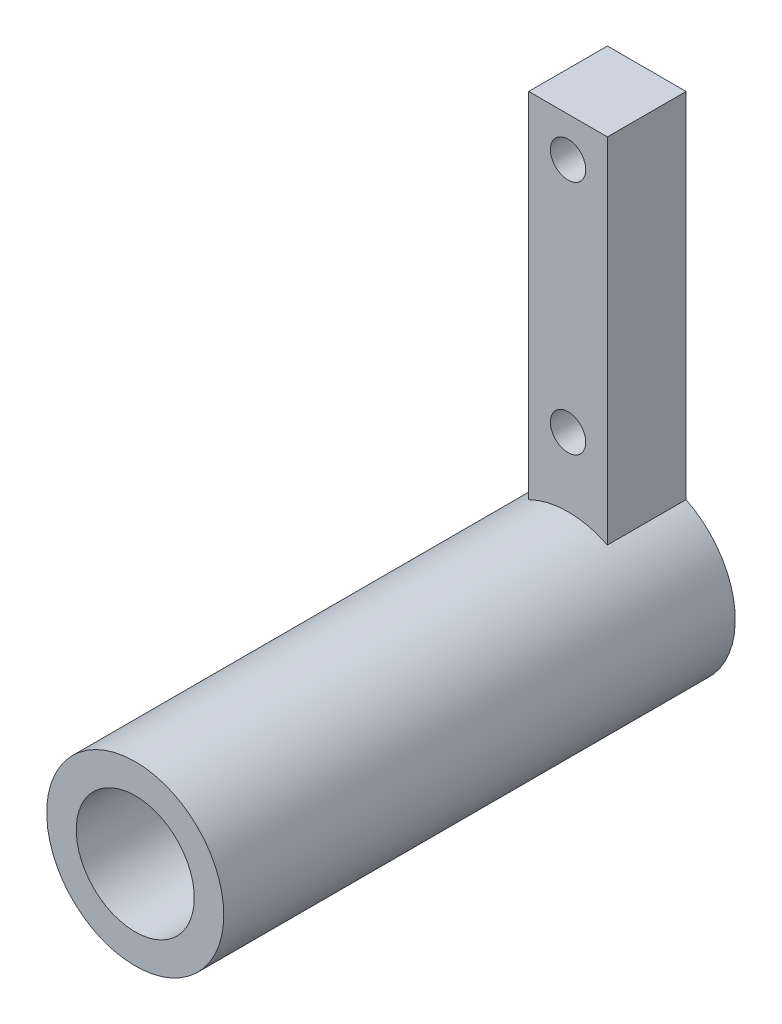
SolidWorks part; units mm, degrees
ref_plane "Plan1" through (0, 0, 0) normal (0, 0, 1) x (1, 0, 0)
ref_plane "Plan2" through (0, 0, 0) normal (0, 1, 0) x (1, 0, 0)
ref_plane "Plan3" through (0, 0, 0) normal (1, 0, 0) x (0, 0, -1)
sketch "Esquisse1" plane through (0, 0, 0) normal (0, 0, 1) x (1, 0, 0)
  circle A0 centre (0, 0) radius 22.5
extrude "Base-Extrusion" add sketch "Esquisse1" along normal blind 130
sketch "Esquisse2" plane through (0, 0, 0) normal (0, 1, 0) x (1, 0, 0)
  line L0 (22.5, 0) -> (-22.5, 0) construction
  line L1 (-10, 0) -> (10, 0)
  line L2 (-10, 0) -> (-10, -20)
  line L3 (-10, -20) -> (10, -20)
  line L4 (10, 0) -> (10, -20)
extrude "Boss.-Extru.1" add sketch "Esquisse2" along normal blind 110
sketch "Esquisse3" plane through (0, 0, 20) normal (0, 0, 1) x (1, 0, 0)
  circle A0 centre (0, 100) radius 4.5
  circle A1 centre (0, 40) radius 4.5
extrude "Enlèv. mat.-Extru.1" cut sketch "Esquisse3" against normal blind 20
sketch "Esquisse4" plane through (0, 0, 130) normal (0, 0, 1) x (1, 0, 0)
  circle A0 centre (0, 0) radius 15
extrude "Enlèv. mat.-Extru.2" cut sketch "Esquisse4" against normal blind 120
